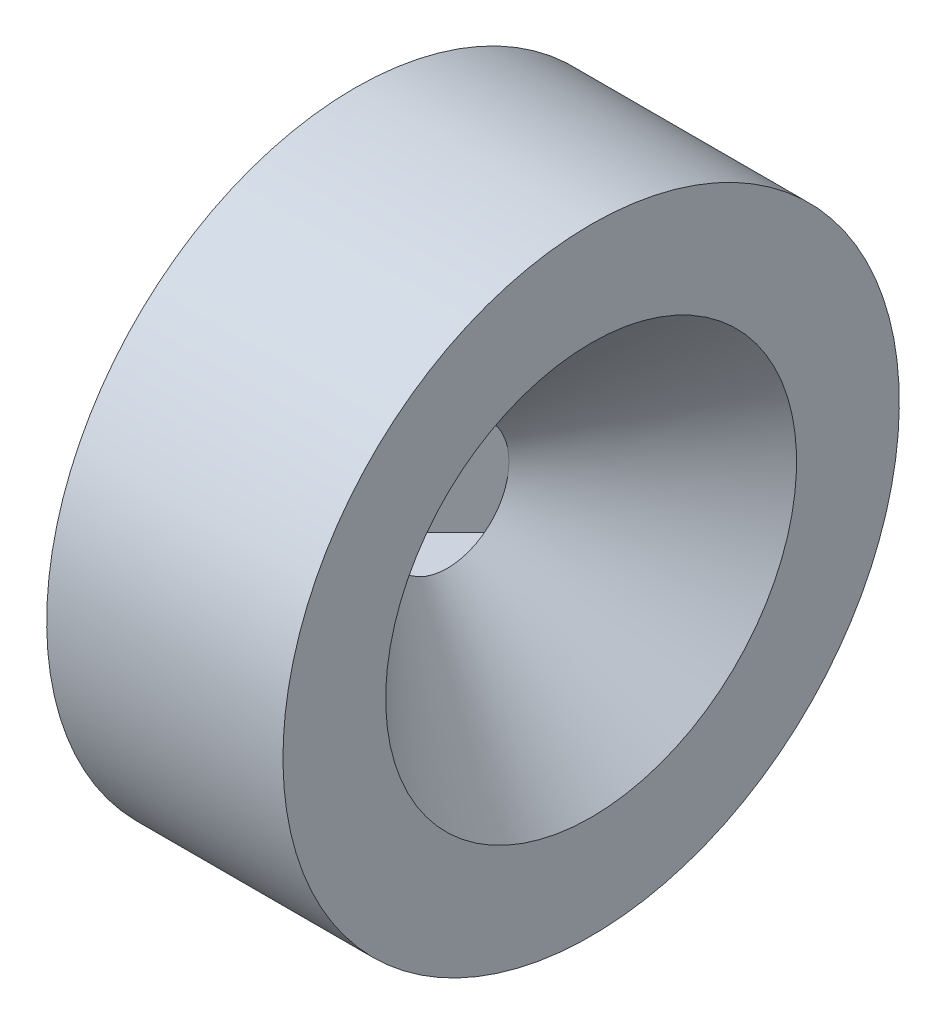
SolidWorks part; units mm, degrees
ref_plane "Front Plane" through (0, 0, 0) normal (0, 0, 1) x (1, 0, 0)
ref_plane "Top Plane" through (0, 0, 0) normal (0, 1, 0) x (1, 0, 0)
ref_plane "Right Plane" through (0, 0, 0) normal (1, 0, 0) x (0, 0, -1)
sketch "Sketch1" plane through (0, 0, 0) normal (0, 0, 1) x (1, 0, 0)
  line L0 (0, 15) -> (0, 0)
  line L1 (0, 0) -> (11.5, 0)
  line L2 (11.5, 0) -> (11.5, 15)
  line L3 (11.5, 15) -> (0, 15)
  line L4 (0, 0) -> (11.5, 0) construction
revolve "Revolve1" add sketch "Sketch1" angle 360 about L4
sketch "Sketch2" plane through (0, 0, 0) normal (-1, 0, 0) x (0, 0, 1)
  circle A0 centre (0, 0) radius 6
extrude "Boss-Extrude1" add sketch "Sketch2" along normal blind 5
ref_plane "Plane1" through (0, 3, 0) normal (0, 1, 0) x (1, 0, 0)
sketch "Sketch3" plane through (0, 3, 0) normal (0, 1, 0) x (1, 0, 0)
  line L0 (4.5, 3) -> (1.5, 0)
  line L1 (1.5, 0) -> (4.5, -3)
  line L2 (4.5, -3) -> (4.5, 3)
extrude "Cut-Extrude1" cut sketch "Sketch3" against normal blind 6
ref_plane "Plane2" through (0, 0, 0) normal (0, 0, -1) x (-1, 0, 0)
sketch "Sketch4" plane through (0, 0, 0) normal (0, 0, -1) x (-1, 0, 0)
  line L0 (-11.5, 10) -> (-11.5, 0)
  line L1 (-11.5, 0) -> (-4.5, 0)
  line L2 (-4.5, 0) -> (-4.5, 3)
  line L3 (-4.5, 3) -> (-11.5, 10)
  line L4 (-11.5, 0) -> (-4.5, 0) construction
revolve "Cut-Revolve1" cut sketch "Sketch4" angle 360 about L4
hole_wizard "Ø10.0 (10) Diameter Hole1" positions "Sketch6" profile "Sketch5" hole size "Ø10.0" standard "ANSI Metric"
sketch "Sketch6" plane through (-5, 0, 0) normal (-1, 0, 0) x (0, 0, 1)
  point P0 (0, 0)
sketch "Sketch5" plane through (-5, 0, 0) normal (0, 1, 0) x (0, 0, 1)
  line L0 (0, 0) -> (0, 5)
  line L1 (0, 5) -> (5, 5)
  line L2 (5, 5) -> (5, 0)
  line L5 (5, 0) -> (0, 0)
  line L10 (0, 5) -> (-5, 5) construction
  line L11 (0, -6.35) -> (0, 107.95) construction
  dimension "Hole Dia." = 10
  dimension "Hole Depth" = 5
  dimension "Drill Angle" = 180
fillet "Fillet1" radius 0.2 1 edges at (1.5, 0, 0)
